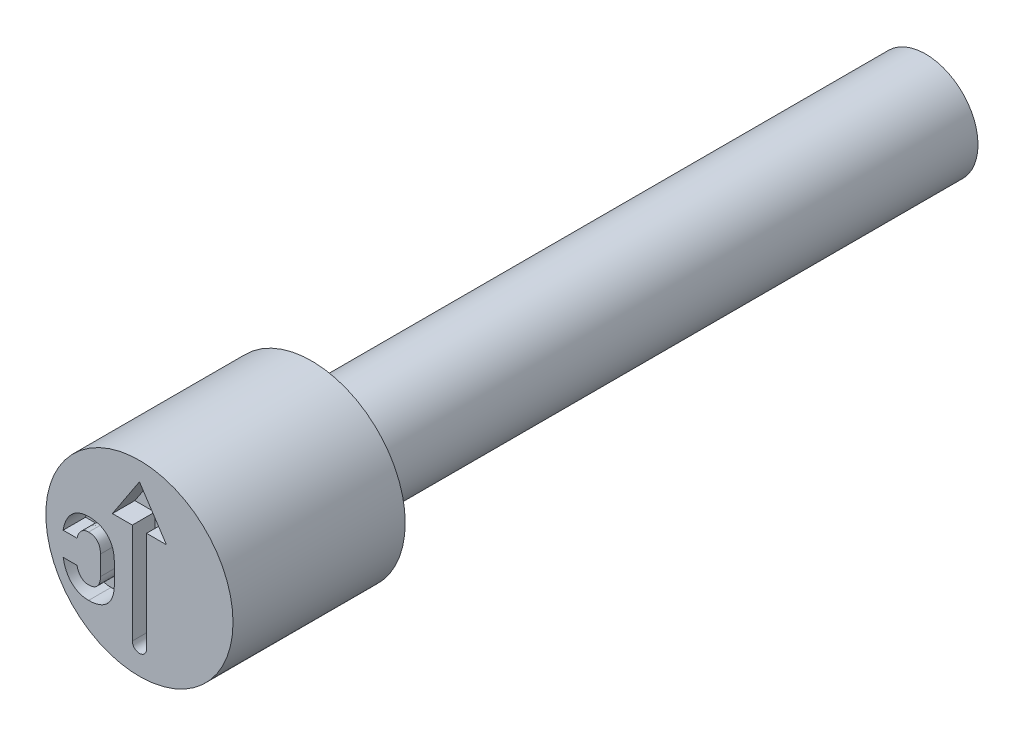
SolidWorks part; units mm, degrees
ref_plane "Front Plane" through (0, 0, 0) normal (0, 0, 1) x (1, 0, 0)
ref_plane "Top Plane" through (0, 0, 0) normal (0, 1, 0) x (1, 0, 0)
ref_plane "Right Plane" through (0, 0, 0) normal (1, 0, 0) x (0, 0, -1)
sketch "Sketch2" plane through (0, 0, 0) normal (1, 0, 0) x (0, 0, -1)
  line L0 (0.4039, 0) -> (50000.4039, 0) construction
  line L6 (0, 1.25) -> (0, 0)
  line L7 (2.3, 1.25) -> (0, 1.25)
  line L8 (2.3, 0.7) -> (2.3, 1.25)
  line L9 (10.5, 0.7) -> (2.3, 0.7)
  line L10 (10.5, 0) -> (10.5, 0.7)
  line L11 (0, 0) -> (10.5, 0)
  dimension "D1" = 2.5
  dimension "D2" = 1.4
  dimension "D3" = 10.5
  dimension "D4" = 2.3
revolve "Revolve1" add sketch "Sketch2" angle 360 about L0
sketch "Sketch3" plane through (0, 0, 0) normal (0, 0, 1) x (1, 0, 0)
  line L0 (0, 0) -> (0, 50000) construction
  line L1 (0.0952, 0.4532) -> (0.0952, -0.8881)
  line L2 (0.361, 0.4532) -> (0.0952, 0.4532)
  line L3 (0, 1.0011) -> (0.361, 0.4532)
  line L15 (0, 1.0011) -> (-0.361, 0.4532)
  line L16 (-0.361, 0.4532) -> (-0.0952, 0.4532)
  line L17 (-0.0952, 0.4532) -> (-0.0952, -0.8881)
  arc A2 (-0.0952, -0.8881) -> (0.0952, -0.8881) centre (0, -0.8881) ccw
extrude "Cut-Extrude4" cut sketch "Sketch3" against normal blind 0.3
sketch "Sketch4" plane through (0, 0, 0) normal (0, 0, 1) x (1, 0, 0)
  text T0 "C" font "Bahnschrift" height 0.95
  dimension "D1" = 0.7
  dimension "D2" = 0.25
extrude "Cut-Extrude5" cut sketch "Sketch4" against normal blind 0.3
